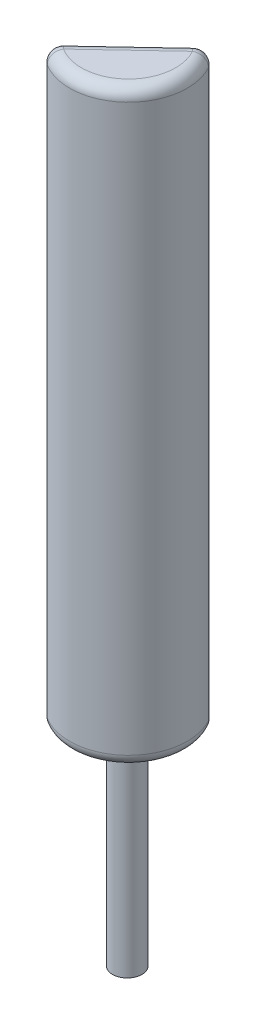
SolidWorks part; units mm, degrees
ref_plane "Front Plane" through (0, 0, 0) normal (0, 0, 1) x (1, 0, 0)
ref_plane "Top Plane" through (0, 0, 0) normal (0, 1, 0) x (1, 0, 0)
ref_plane "Right Plane" through (0, 0, 0) normal (1, 0, 0) x (0, 0, -1)
sketch "Schizzo1" plane through (0, 0, 0) normal (0, 1, 0) x (1, 0, 0)
  line L0 (-2.914, -2.7402) -> (2.914, 2.7402)
  arc A0 (2.914, 2.7402) -> (-2.914, -2.7402) centre (0, 0) cw
  dimension "D1" = 4
extrude "Estrusione-Estrusione1" add sketch "Schizzo1" along normal blind 40
sketch "Schizzo2" plane through (0, 0, 0) normal (0, -1, 0) x (1, 0, 0)
  line L0 (0, 0) -> (2.7402, 2.914) construction
  arc A0 (2.914, -2.7402) -> (-2.914, 2.7402) centre (0, 0) ccw construction
  circle A1 centre (1.3701, 1.457) radius 1
  dimension "D1" = 2
extrude "Estrusione-Estrusione2" add sketch "Schizzo2" along normal blind 13
fillet "Raccordo1" radius 0.8 6 edges at (2.7402, 0, 2.914) (2.7402, 40, 2.914) (0, 0, 0) (0, 40, 0) (-2.914, 20, 2.7402) (2.914, 20, -2.7402)
sketch "Sketch1" plane through (0, 0, 0) normal (0, -1, 0) x (1, 0, 0)
  line L0 (2.2572, -2.1226) -> (-2.2572, 2.1226) construction
  line L1 (2.2572, -2.1226) -> (-2.2572, 2.1226)
  circle A0 centre (1.3701, 1.457) radius 1 construction
  circle A1 centre (1.3701, 1.457) radius 1
